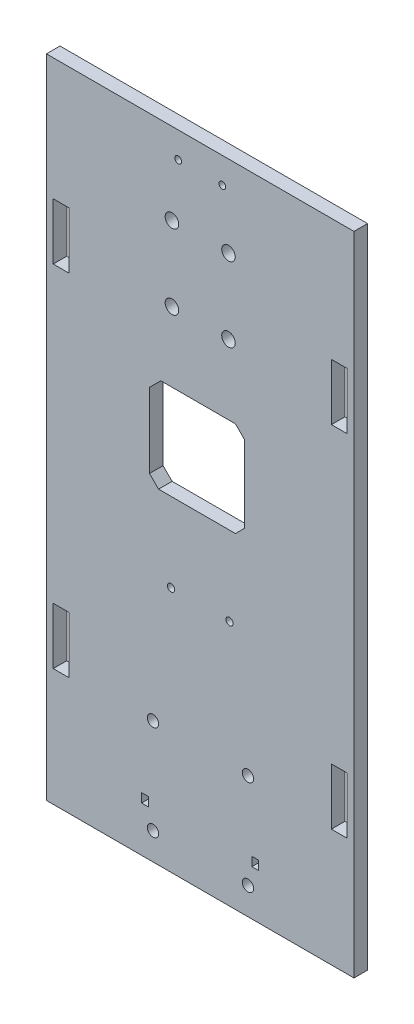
SolidWorks part; units mm, degrees
ref_plane "Front Plane" through (0, 0, 0) normal (0, 0, 1) x (1, 0, 0)
ref_plane "Top Plane" through (0, 0, 0) normal (0, 1, 0) x (1, 0, 0)
ref_plane "Right Plane" through (0, 0, 0) normal (1, 0, 0) x (0, 0, -1)
sketch "Sketch2" plane through (0, 0, 0) normal (0, 0, 1) x (1, 0, 0)
  line L0 (-33.1964, 22.8855) -> (-33.1964, -10.1145)
  line L1 (-10.769, -34.1145) -> (-10.769, 123.8076) construction
  line L3 (-77.269, 127.8076) -> (-78.769, 127.8076)
  line L4 (4.8036, 27.8855) -> (-28.1964, 27.8855)
  line L5 (-78.769, 127.8076) -> (-78.769, -156.1145)
  line L6 (-78.769, -156.1145) -> (-78.769, -158.1145)
  line L7 (55.731, 127.8076) -> (57.231, 127.8076)
  line L10 (57.231, 127.8076) -> (57.231, -156.1145)
  line L11 (4.8036, 27.8855) -> (8.8036, 23.8855)
  line L12 (-33.1964, 22.8855) -> (-28.1964, 27.8855)
  line L13 (8.8036, 23.8855) -> (8.8036, -10.1145)
  line L19 (-33.1964, -10.1145) -> (-29.1964, -14.1145)
  line L20 (4.8036, -14.1145) -> (-29.1964, -14.1145)
  line L21 (4.8036, -14.1145) -> (8.8036, -10.1145)
  line L47 (-33.7162, -134.0804) -> (-33.7162, -138.0804)
  line L48 (-33.7162, -138.0804) -> (-36.7162, -138.0804)
  line L49 (-36.7162, -138.0804) -> (-36.7162, -134.0804)
  line L50 (-36.7162, -134.0804) -> (-33.7162, -134.0804)
  line L51 (12.0519, -134.0755) -> (12.0519, -138.0755)
  line L52 (12.0519, -138.0755) -> (15.0519, -138.0755)
  line L53 (15.0519, -138.0755) -> (15.0519, -134.0755)
  line L54 (15.0519, -134.0755) -> (12.0519, -134.0755)
  line L55 (-78.769, -158.1145) -> (57.231, -158.1145)
  line L56 (54.231, -81.1145) -> (47.231, -81.1145)
  line L57 (54.231, 73.8076) -> (47.231, 73.8076)
  line L58 (-75.769, 48.8076) -> (-68.769, 48.8076)
  line L59 (47.231, -81.1145) -> (47.231, -106.1145)
  line L60 (47.231, -106.1145) -> (54.231, -106.1145)
  line L61 (-68.769, 48.8076) -> (-68.769, 73.8076)
  line L62 (-75.769, -106.1145) -> (-68.769, -106.1145)
  line L63 (-68.769, -106.1145) -> (-68.769, -81.1145)
  line L64 (-68.769, -81.1145) -> (-75.769, -81.1145)
  line L65 (-75.769, -81.1145) -> (-75.769, -106.1145)
  line L66 (-68.769, 73.8076) -> (-75.769, 73.8076)
  line L67 (-75.769, 73.8076) -> (-75.769, 48.8076)
  line L68 (47.231, 73.8076) -> (47.231, 48.8076)
  line L69 (47.231, 48.8076) -> (54.231, 48.8076)
  line L70 (54.231, 48.8076) -> (54.231, 73.8076)
  line L71 (54.231, -106.1145) -> (54.231, -81.1145)
  line L72 (-77.269, 127.8076) -> (55.731, 127.8076)
  line L73 (57.231, -158.1145) -> (57.231, -156.1145)
  circle A0 centre (-23.669, -49.1145) radius 1.6
  circle A1 centre (1.731, 91.7387) radius 3
  circle A2 centre (-23.269, 58.7387) radius 3
  circle A5 centre (2.1868, -49.1145) radius 1.6
  circle A8 centre (-20.4878, 116.3531) radius 1.5
  circle A9 centre (-0.9878, 116.3531) radius 1.5
  circle A10 centre (-31.649, -146.1145) radius 2.5
  circle A11 centre (10.351, -146.1145) radius 2.5
  circle A12 centre (-31.6682, -104.0807) radius 2.5
  circle A13 centre (10.327, -104.0895) radius 2.5
  circle A14 centre (1.731, 58.7387) radius 3
  circle A16 centre (-23.269, 91.7387) radius 3
  dimension "D2" = 25
  dimension "D7" = 42.025
  dimension "D8" = 42.0339
extrude "Boss-Extrude1" add sketch "Sketch2" along normal blind 6
